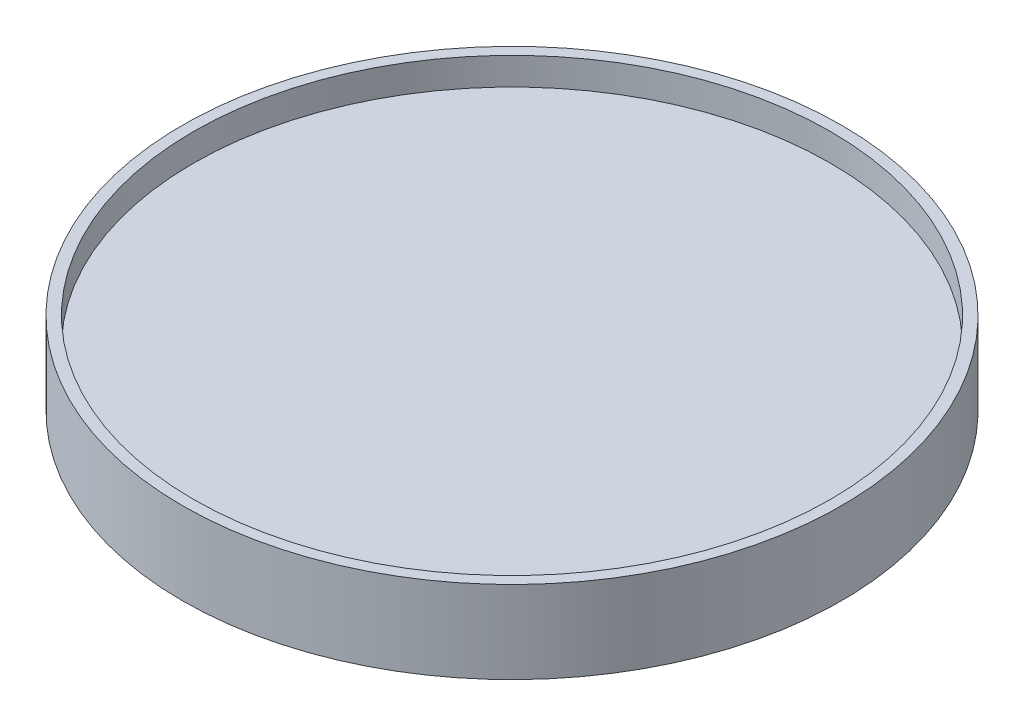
SolidWorks part; units mm, degrees
ref_plane "Front Plane" through (0, 0, 0) normal (0, 0, 1) x (1, 0, 0)
ref_plane "Top Plane" through (0, 0, 0) normal (0, 1, 0) x (1, 0, 0)
ref_plane "Right Plane" through (0, 0, 0) normal (1, 0, 0) x (0, 0, -1)
sketch "Sketch1" plane through (0, 0, 0) normal (0, 1, 0) x (1, 0, 0)
  circle A0 centre (0, 0) radius 76.2
  dimension "D1" = 152.4
extrude "Boss-Extrude1" add sketch "Sketch1" along normal blind 12.7
sketch "Sketch2" plane through (0, 12.7, 0) normal (0, 1, 0) x (1, 0, 0)
  circle A0 centre (0, 0) radius 73.66
  circle A1 centre (0, 0) radius 76.2 construction
  circle A2 centre (0, 0) radius 76.2
  dimension "D1" = 147.32
extrude "Boss-Extrude2" add sketch "Sketch2" along normal blind 6.35
